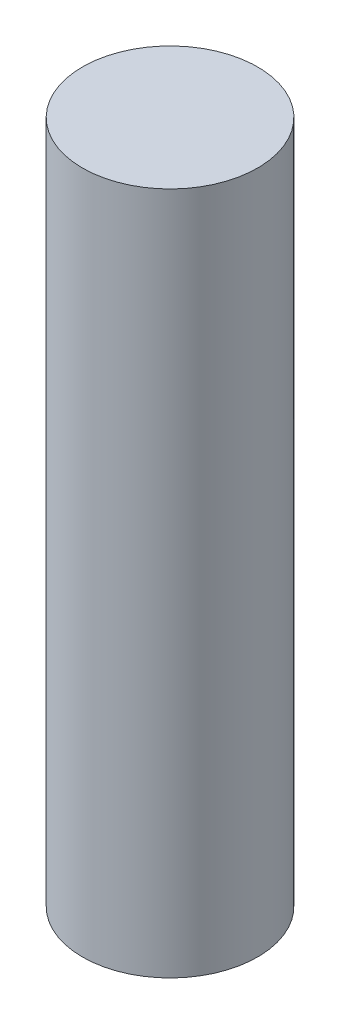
SolidWorks part; units mm, degrees
ref_plane "Front Plane" through (0, 0, 0) normal (0, 0, 1) x (1, 0, 0)
ref_plane "Top Plane" through (0, 0, 0) normal (0, 1, 0) x (1, 0, 0)
ref_plane "Right Plane" through (0, 0, 0) normal (1, 0, 0) x (0, 0, -1)
sketch "Sketch1" plane through (0, 0, 0) normal (0, 1, 0) x (1, 0, 0)
  circle A0 centre (0, 0) radius 5
  dimension "D1" = 10
extrude "Extrude1" add sketch "Sketch1" along normal blind 39
